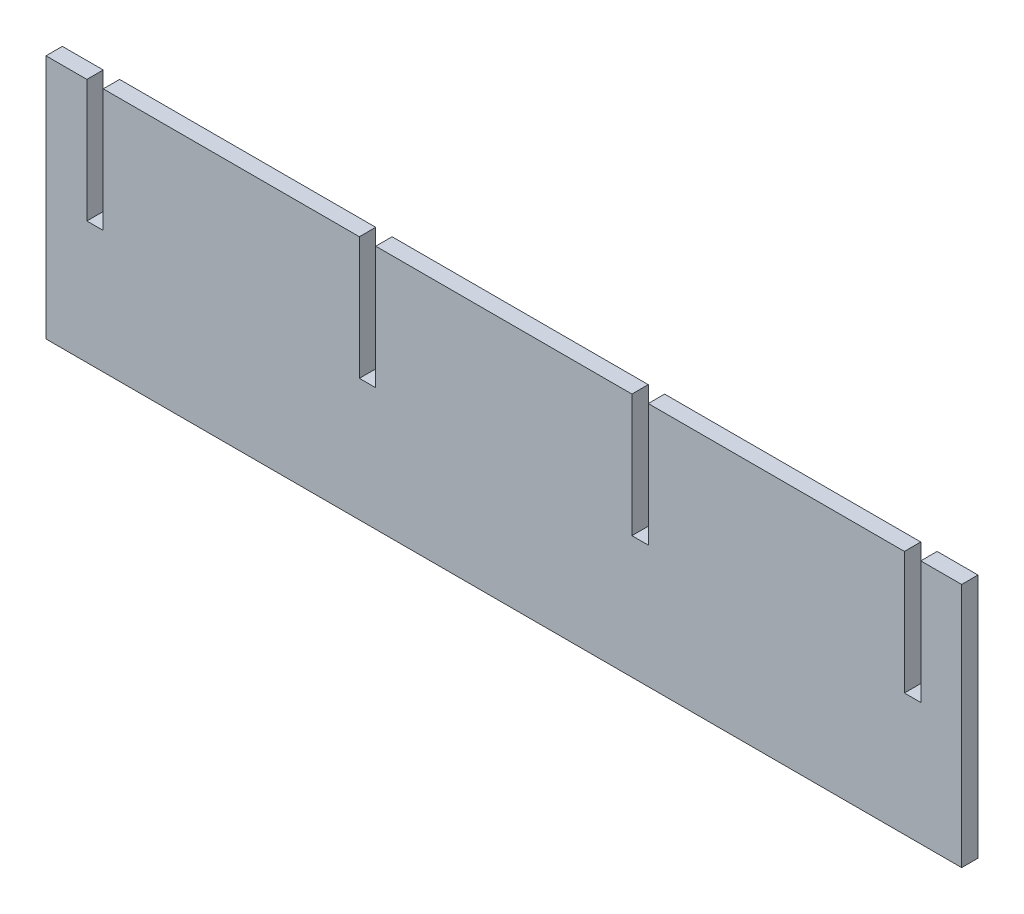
SolidWorks part; units mm, degrees
ref_plane "Alzado" through (0, 0, 0) normal (1, 0, 0) x (0, 1, 0)
ref_plane "Planta" through (0, 0, 0) normal (0, 0, 1) x (0, 1, 0)
ref_plane "Vista lateral" through (0, 0, 0) normal (0, 1, 0) x (-1, 0, 0)
sketch "Sketch3" plane through (0, 0, 0) normal (0, 0, 1) x (0, 1, 0)
  line L0 (90, -94) -> (90, -106)
  line L1 (-90, 336) -> (90, 336)
  line L2 (-90, 336) -> (-90, -336)
  line L3 (-90, -336) -> (90, -336)
  line L4 (90, 336) -> (90, -336)
  line L5 (-90, 336) -> (90, -336) construction
  line L6 (-90, -336) -> (90, 336) construction
  line L7 (90, -294) -> (0, -294)
  line L8 (90, -294) -> (90, -306)
  line L9 (90, -306) -> (0, -306)
  line L10 (0, -294) -> (0, -306)
  line L11 (90, -94) -> (0, -94)
  line L12 (0, -94) -> (0, -106)
  line L13 (90, -106) -> (0, -106)
  line L14 (90, -294) -> (90, -94) construction
  line L15 (90, 106) -> (90, 94)
  line L16 (90, 106) -> (0, 106)
  line L17 (0, 106) -> (0, 94)
  line L18 (90, 94) -> (0, 94)
  line L19 (90, 306) -> (90, 294)
  line L20 (90, 306) -> (0, 306)
  line L21 (0, 306) -> (0, 294)
  line L22 (90, 294) -> (0, 294)
  point P0 (0, 0)
extrude "Boss-Extrude1" add sketch "Sketch3" along normal blind 12
equation "\"L\"=180"
equation "\"D1@Sketch3\"=\"L\""
equation "\"W\"=12"
equation "\"D3@Sketch3\"=\"W\""
equation "\"D4@Sketch3\"=\"L\"/2"
equation "\"H\"=1700"
equation "\"D2@Sketch3\" = ( ( \"K\" * ( \"N\" - 1 ) ) + ( \"B\" * 2 ) ) + \"W\""
equation "\"B\"=30"
equation "\"D5@Sketch3\"=\"B\""
equation "\"K\"=200"
equation "\"D7@Sketch3\"=\"K\""
equation "\"D6@Sketch3\"=\"N\""
equation "\"N\"=4"
